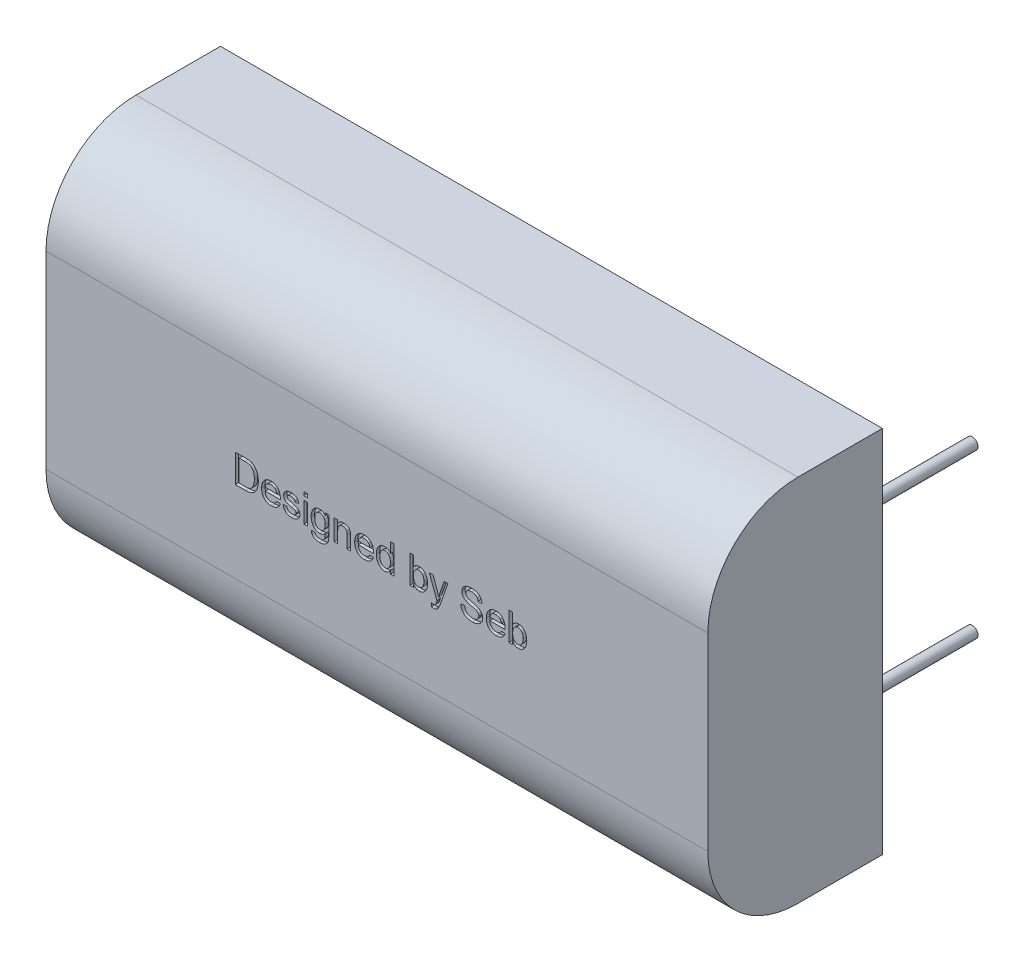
SolidWorks part; units mm, degrees
ref_plane "Front Plane" through (0, 0, 0) normal (0, 0, 1) x (1, 0, 0)
ref_plane "Top Plane" through (0, 0, 0) normal (0, 1, 0) x (1, 0, 0)
ref_plane "Right Plane" through (0, 0, 0) normal (1, 0, 0) x (0, 0, -1)
sketch "Sketch1" plane through (0, 0, 0) normal (1, 0, 0) x (0, 0, -1)
  line L1 (7.75, -16.4) -> (-7.75, -16.4)
  line L2 (7.75, -16.4) -> (7.75, 16.4)
  line L3 (7.75, 16.4) -> (-7.75, 16.4)
  line L4 (-7.75, -16.4) -> (-7.75, 16.4)
  line L5 (7.75, -16.4) -> (-7.75, 16.4) construction
  line L6 (7.75, 16.4) -> (-7.75, -16.4) construction
  point P0 (0, 0)
  dimension "D1" = 15.5
  dimension "D2" = 32.8
extrude "Boss-Extrude1" add sketch "Sketch1" along normal mid plane 58.8
fillet "Fillet1" radius 8 2 edges at (0, -16.4, 7.75) (0, 16.4, 7.75)
sketch "Sketch2" plane through (0, 0, -7.75) normal (0, 0, -1) x (-1, 0, 0)
  line L0 (-25.4, 16.4) -> (-25.4, -16.4) construction
  line L1 (-29.4, 16.4) -> (29.4, 16.4) construction
  line L2 (-29.4, -16.4) -> (29.4, -16.4) construction
  line L3 (-29.4, -16.4) -> (-29.4, 16.4) construction
  line L4 (-31.6502, 0) -> (31.6117, 0) construction
  line L5 (8.525, 0) -> (-8.525, 0) construction
  circle A0 centre (-25.4, 7.25) radius 0.5
  circle A1 centre (-25.4, -7.25) radius 0.5
  dimension "D2" = 1
  dimension "D1" = 4
  dimension "D3" = 14.5
extrude "Boss-Extrude2" add sketch "Sketch2" along normal blind 12 contours A0
sketch "Sketch3" plane through (0, 0, 7.75) normal (0, 0, 1) x (1, 0, 0)
  text T0 "Designed by Seb"
extrude "Cut-Extrude1" cut sketch "Sketch3" against normal blind 0.3
